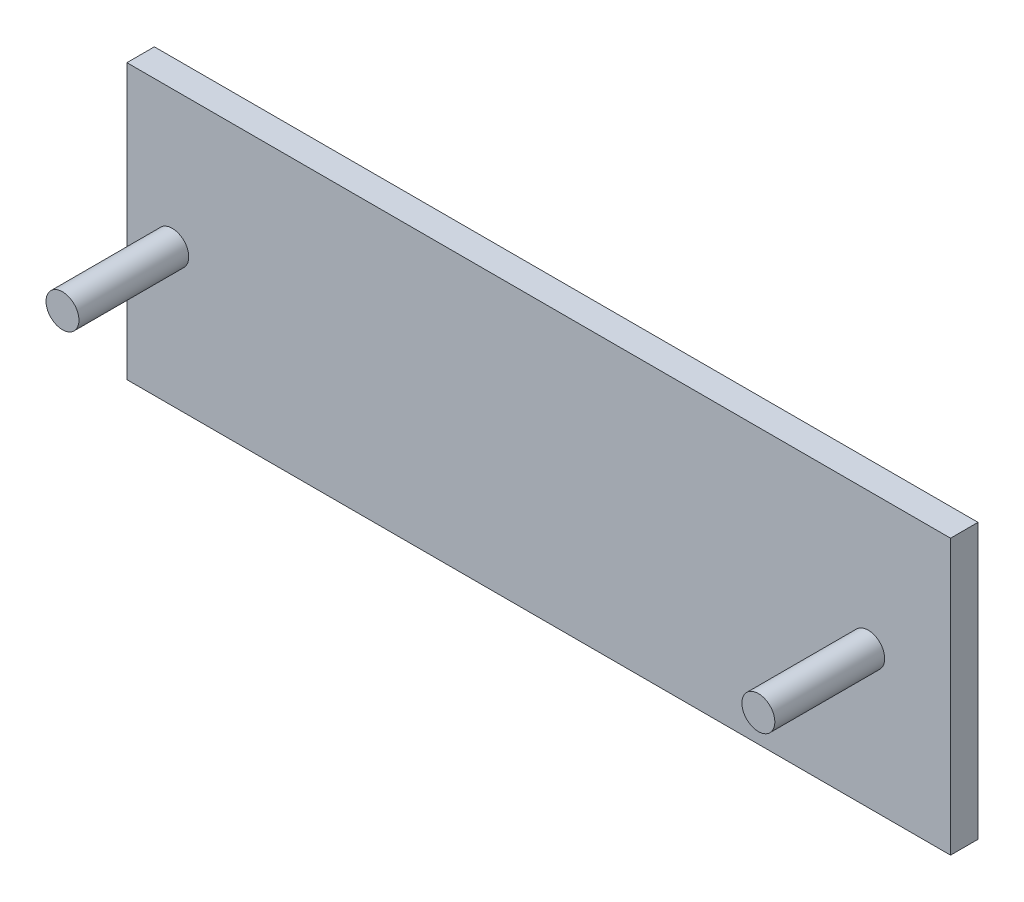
SolidWorks part; units mm, degrees
ref_plane "Ebene vorne" through (0, 0, 0) normal (0, 0, 1) x (1, 0, 0)
ref_plane "Ebene oben" through (0, 0, 0) normal (0, 1, 0) x (1, 0, 0)
ref_plane "Ebene rechts" through (0, 0, 0) normal (1, 0, 0) x (0, 0, -1)
sketch "Skizze1" plane through (0, 0, 0) normal (0, 0, 1) x (1, 0, 0)
  line L0 (0, 0) -> (300, 0)
  line L1 (300, 0) -> (300, 100)
  line L2 (300, 100) -> (0, 100)
  line L3 (0, 100) -> (0, 0)
extrude "Linear austragen1" add sketch "Skizze1" along normal blind 10
sketch "Skizze2" plane through (0, 0, 10) normal (0, 0, 1) x (1, 0, 0)
  line L0 (0, 0) -> (300, 0) construction
  line L1 (0, 100) -> (0, 0) construction
  circle A0 centre (16.53, 50) radius 6
  dimension "D1" = 50
  dimension "D2" = 16.53
extrude "Linear austragen2" add sketch "Skizze2" along normal blind 40
sketch "Skizze3" plane through (0, 0, 10) normal (0, 0, 1) x (1, 0, 0)
  circle A0 centre (270, 50) radius 6
extrude "Linear austragen3" add sketch "Skizze3" along normal blind 40
